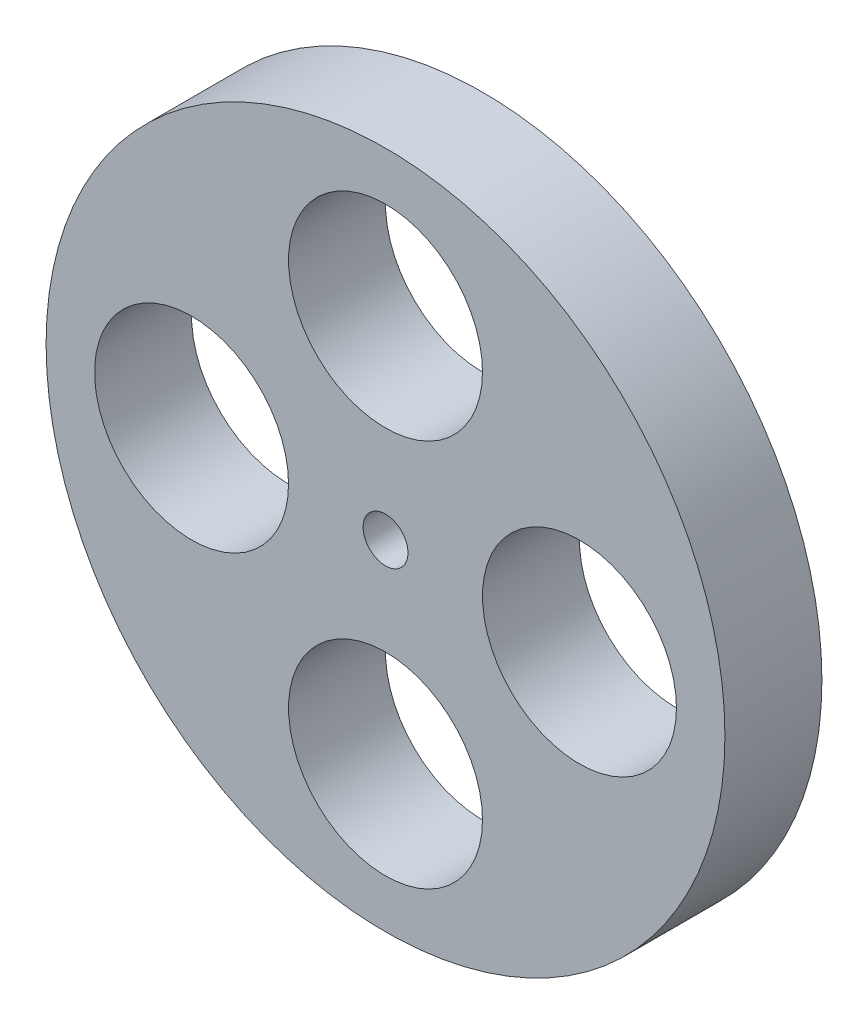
SolidWorks part; units mm, degrees
ref_plane "Front Plane" through (0, 0, 0) normal (0, 0, 1) x (1, 0, 0)
ref_plane "Top Plane" through (0, 0, 0) normal (0, 1, 0) x (1, 0, 0)
ref_plane "Right Plane" through (0, 0, 0) normal (1, 0, 0) x (0, 0, -1)
sketch "Sketch1" plane through (0, 0, 0) normal (0, 0, 1) x (1, 0, 0)
  circle A0 centre (0, 0) radius 44.45
  circle A1 centre (0, 0) radius 2.9365
  circle A2 centre (0, 25.4) radius 12.7
  circle A3 centre (25.4, 0) radius 12.7
  circle A4 centre (0, -25.4) radius 12.7
  circle A5 centre (-25.4, 0) radius 12.7
  point P15 (0, 0)
  dimension "D1" = 88.9
  dimension "D2" = 5.873
  dimension "D3" = 25.4
  dimension "D4" = 25.4
  dimension "D5" = 4
extrude "Boss-Extrude1" add sketch "Sketch1" along normal blind 12.7
